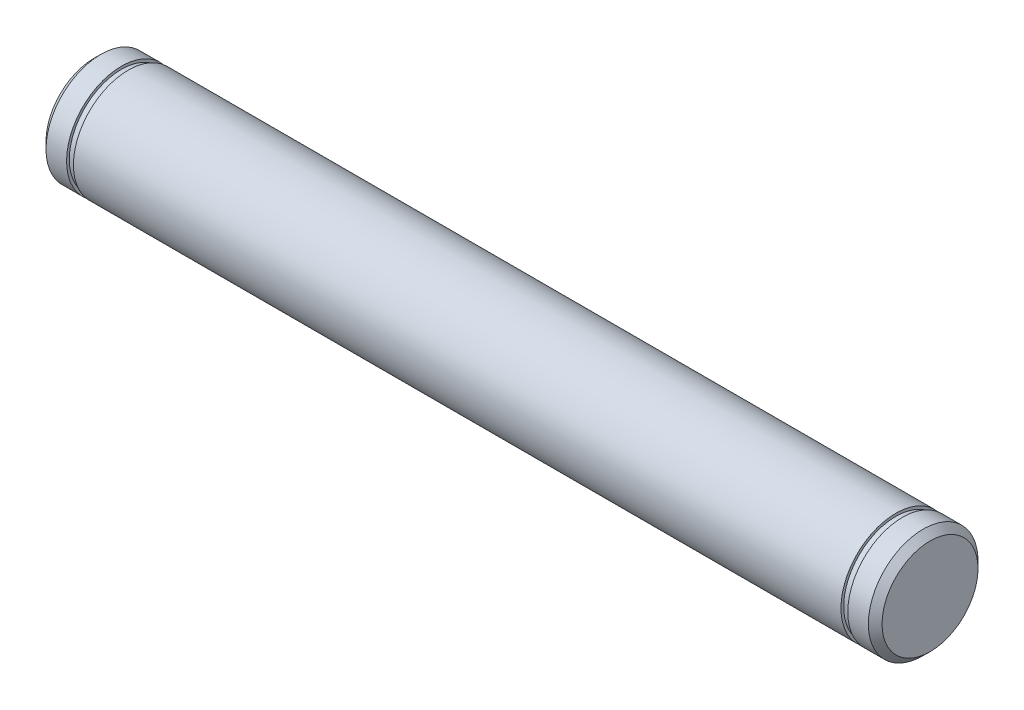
SolidWorks part; units mm, degrees
ref_plane "Front" through (0, 0, 0) normal (0, 0, 1) x (1, 0, 0)
ref_plane "Top" through (0, 0, 0) normal (0, 1, 0) x (1, 0, 0)
ref_plane "Right" through (0, 0, 0) normal (1, 0, 0) x (0, 0, -1)
sketch "Sketch1" plane through (0, 0, 0) normal (1, 0, 0) x (0, 0, -1)
  circle A0 centre (0, 0) radius 2
  dimension "D1" = 4
extrude "Boss-Extrude1" add sketch "Sketch1" along normal blind 30.5
sketch "Sketch2" plane through (30.5, 0, 0) normal (1, 0, 0) x (0, 0, -1)
  circle A0 centre (0, 0) radius 1.9
  circle A1 centre (0, 0) radius 2.4981
  dimension "D1" = 3.8
extrude "Cut-Extrude2" cut sketch "Sketch2" against normal blind 0.25 from offset 1
sketch "Sketch3" plane through (0, 0, 0) normal (-1, 0, 0) x (0, 0, 1)
  circle A0 centre (0, 0) radius 1.9
  circle A1 centre (0, 0) radius 2.5
extrude "Cut-Extrude3" cut sketch "Sketch3" against normal blind 0.25 from offset 1
chamfer "Chamfer1" distance 0.25 angle 45 2 edges at (0, 0, -2) (30.5, 0, -2)
